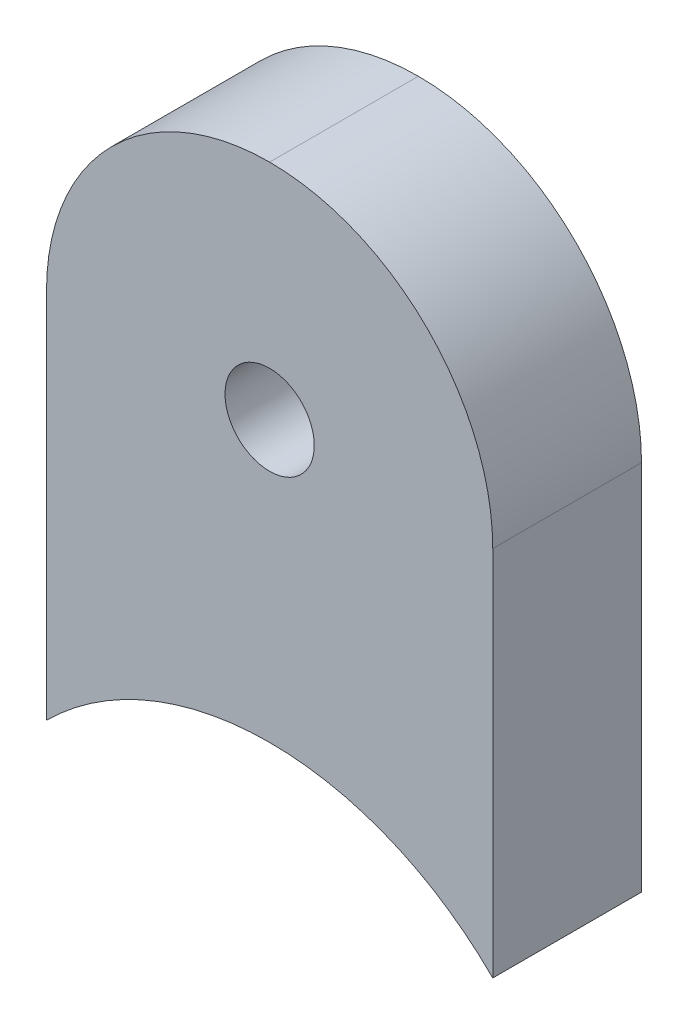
SolidWorks part; units mm, degrees
ref_plane "Plan de face" through (0, 0, 0) normal (0, 0, 1) x (1, 0, 0)
ref_plane "Plan de dessus" through (0, 0, 0) normal (0, 1, 0) x (1, 0, 0)
ref_plane "Plan de droite" through (0, 0, 0) normal (1, 0, 0) x (0, 0, -1)
sketch "Esquisse1" plane through (0, 0, 0) normal (0, 0, 1) x (1, 0, 0)
  line L1 (-30, 0) -> (-30, 40)
  line L2 (-30, 40) -> (0, 40)
  line L3 (0, 40) -> (0, 0)
  arc A0 (-30, 0) -> (0, 0) centre (-15, -15) cw
  dimension "D1" = 30
  dimension "D2" = 40
extrude "Extrusion1" add sketch "Esquisse1" along normal blind 10
fillet "Congé1" radius 15 2 edges at (-30, 40, 5) (0, 40, 5)
ref_plane "Plan2" through (0, 0, 30) normal (0, 0, 1) x (1, 0, 0)
sketch "Esquisse10" plane through (0, 0, 30) normal (0, 0, 1) x (1, 0, 0)
  circle A0 centre (-15, 25) radius 3
extrude "Enlèv. mat.-Extru.1" cut sketch "Esquisse10" against normal through all
